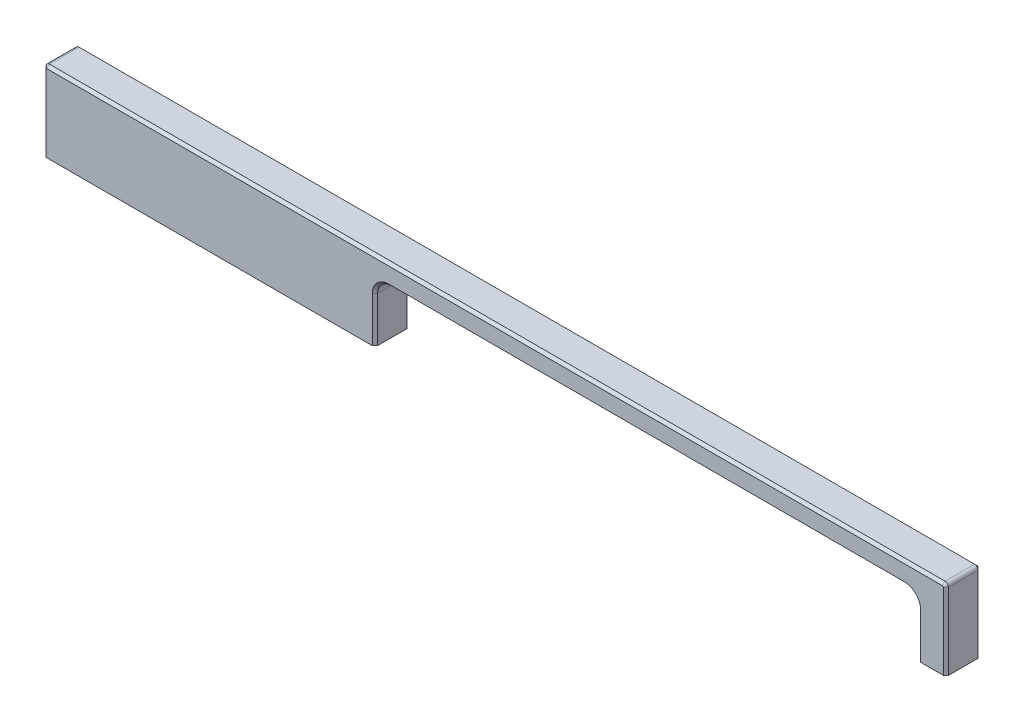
SolidWorks part; units mm, degrees
ref_plane "正面" through (0, 0, 0) normal (0, 0, 1) x (1, 0, 0)
ref_plane "平面" through (0, 0, 0) normal (0, 1, 0) x (1, 0, 0)
ref_plane "右側面" through (0, 0, 0) normal (1, 0, 0) x (0, 0, -1)
sketch "ｽｹｯﾁ1" plane through (0, 0, 0) normal (0, 0, 1) x (1, 0, 0)
  line L0 (130, 0) -> (122, 0)
  line L1 (122, 0) -> (122, 17)
  line L2 (122, 17) -> (-34.5, 17)
  line L3 (-34.5, 17) -> (-34.5, 0)
  line L4 (-34.5, 0) -> (-130, 0)
  line L5 (-130, 0) -> (-130, 23)
  line L6 (-130, 23) -> (130, 23)
  line L7 (130, 23) -> (130, 0)
  line L8 (0, 0) -> (0, 5.2386) construction
  dimension "D1" = 8
  dimension "D2" = 260
  dimension "D3" = 23
  dimension "D4" = 6
  dimension "D5" = 95.5
extrude "ﾎﾞｽ - 押し出し1" add sketch "ｽｹｯﾁ1" along normal mid plane 10
hole_wizard "M4x0.7 ねじ穴1" positions "ｽｹｯﾁ2" profile "ｽｹｯﾁ3" tap size "M4x0.7" standard "Ansi Metric"
sketch "ｽｹｯﾁ2" plane through (0, 0, 0) normal (0, -1, 0) x (-1, 0, 0)
  line L0 (74, 0) -> (-126, 0) construction
  line L2 (-122, -5) -> (-122, 5) construction
  point P0 (-126, 0)
  point P2 (74, 0)
  dimension "D1" = 4
  dimension "D2" = 200
sketch "ｽｹｯﾁ3" plane through (126, 0, 0) normal (1, 0, 0) x (0, 0, -1)
  line L0 (0, 0) -> (0, 12.4914)
  line L1 (0, 12.4914) -> (1.65, 11.5)
  line L2 (1.65, 11.5) -> (1.65, 0)
  line L5 (1.65, 0) -> (0, 0)
  line L10 (0, 12.4914) -> (-1.65, 11.5) construction
  line L11 (0, -6.35) -> (0, 107.95) construction
  dimension "ねじ下穴ﾄﾞﾘﾙ直径" = 3.3
  dimension "ねじ下穴ﾄﾞﾘﾙの深さ" = 11.5
  dimension "ﾄﾞﾘﾙ角度" = 118
fillet "ﾌｨﾚｯﾄ1" radius 4 2 edges at (122, 17, 0) (-34.5, 17, 0)
fillet "ﾌｨﾚｯﾄ2" radius 1 2 edges at (130, 23, 0) (-130, 23, 0)
chamfer "面取り1" distance 0.75 angle 45 20 edges at (122, 6.5, -5) (120.8284, 15.8284, -5) (43.75, 17, -5) (-33.3284, 15.8284, -5) (-34.5, 6.5, -5) (130, 11, -5) (129.7071, 22.7071, -5) (0, 23, -5) (-129.7071, 22.7071, -5) (-130, 11, -5) (122, 6.5, 5) (120.8284, 15.8284, 5) (43.75, 17, 5) (-33.3284, 15.8284, 5) (-34.5, 6.5, 5) (130, 11, 5) (129.7071, 22.7071, 5) (0, 23, 5) (-129.7071, 22.7071, 5) (-130, 11, 5)
